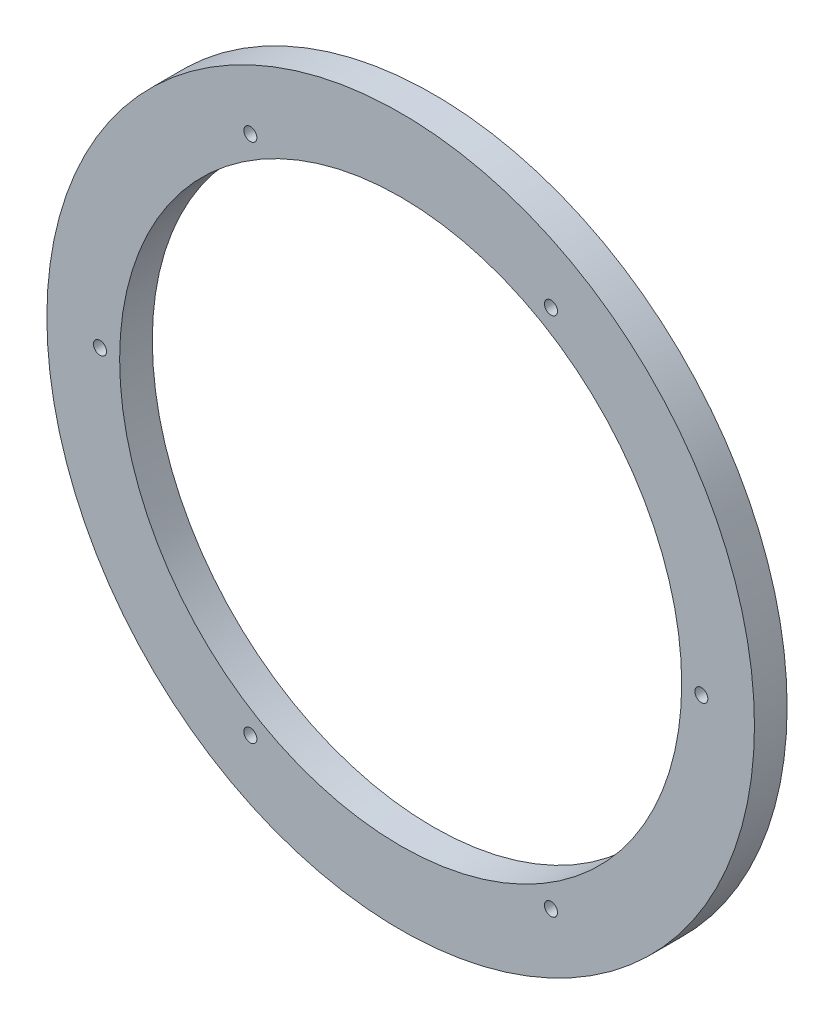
SolidWorks part; units mm, degrees
ref_plane "Front Plane" through (0, 0, 0) normal (0, 0, 1) x (1, 0, 0)
ref_plane "Top Plane" through (0, 0, 0) normal (0, 1, 0) x (1, 0, 0)
ref_plane "Right Plane" through (0, 0, 0) normal (1, 0, 0) x (0, 0, -1)
sketch "Sketch1" plane through (0, 0, 0) normal (0, 0, 1) x (1, 0, 0)
  circle A0 centre (0, 0) radius 103.124
  circle A1 centre (0, 0) radius 81.915
  dimension "D1" = 163.83
  dimension "D2" = 206.248
extrude "Boss-Extrude1" add sketch "Sketch1" against normal blind 9.525
hole_wizard "#10-24 Tapped Hole1" positions "Sketch3" profile "Sketch2" tap size "#10-24" standard "Ansi Inch"
sketch "Sketch3" plane through (0, 0, 0) normal (0, 0, 1) x (1, 0, 0)
  circle A0 centre (0, 0) radius 87.63 construction
  point P0 (-87.63, 0)
  point P15 (-43.8145, 75.8907)
  point P16 (43.8165, 75.8907)
  point P17 (87.632, 0)
  point P18 (43.8165, -75.8907)
  point P19 (-43.8145, -75.8907)
  dimension "D1" = 175.26
  dimension "D2" = 6
sketch "Sketch2" plane through (-87.63, 0, 0) normal (1, 0, 0) x (0, -1, 0)
  line L0 (0, 0) -> (0, 9.525)
  line L1 (0, 9.525) -> (1.8986, 9.525)
  line L2 (1.8986, 9.525) -> (1.8986, 0)
  line L5 (1.8986, 0) -> (0, 0)
  line L11 (0, -6.35) -> (0, 107.95) construction
  dimension "Thru Tap Drill Dia." = 3.7973
  dimension "Thru Tap Drill Depth" = 9.525
equation "\"Buoyancy\"=\"SW-Volume\"*(\"SW-Density\"-.037062)"
